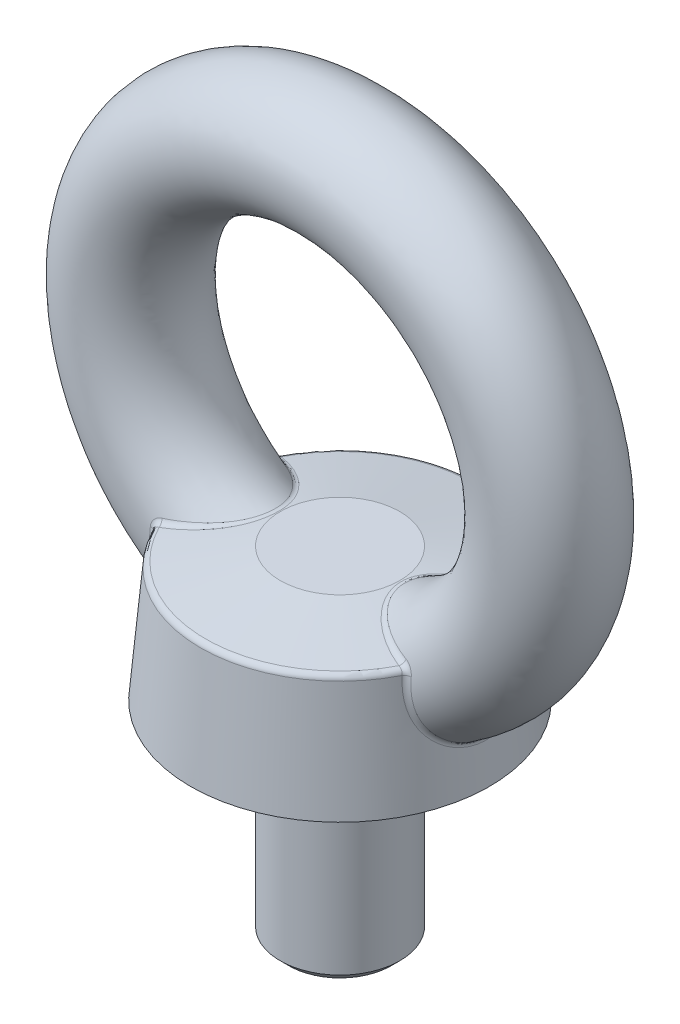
SolidWorks part; units mm, degrees
ref_plane "Front Plane" through (0, 0, 0) normal (0, 0, 1) x (1, 0, 0)
ref_plane "Top Plane" through (0, 0, 0) normal (0, 1, 0) x (1, 0, 0)
ref_plane "Right Plane" through (0, 0, 0) normal (1, 0, 0) x (0, 0, -1)
sketch "Sketch1" plane through (0, 0, 0) normal (0, 0, 1) x (1, 0, 0)
  ellipse E0 centre (0, 26.5) end of major axis (27, 26.5) minor radius 26.5
  dimension "D1" = 54
  dimension "D2" = 53
sketch "Sketch2" plane through (0, 0, 0) normal (1, 0, 0) x (0, 0, -1)
  line L3 (0, 53) -> (0, 0) construction
  circle A0 centre (0, 6) radius 6
  point P5 (0, 0)
sweep "Sweep1" add profiles "Sketch2" path "Sketch1"
sketch "Sketch3" plane through (0, 0, 0) normal (1, 0, 0) x (0, 0, -1)
  line L0 (0, 0) -> (-15, 0)
  line L1 (-15, 0) -> (-13.9501, 12)
  line L2 (-13.9501, 12) -> (-6, 13.4018)
  line L3 (-6, 13.4018) -> (0, 13.4018)
  line L4 (0, 13.4018) -> (0, 0)
revolve "Revolve1" add sketch "Sketch3" angle 360 about L4
fillet "Fillet1" radius 0.6 6 edges at (6.3535, 13.335, 0.5697) (14.6193, 4.2467, 0.517) (-6.3535, 13.335, -0.5697) (-14.6193, 4.2467, -0.517) (0, 12, -13.9501) (0, 12, 13.9501)
sketch "Sketch4" plane through (0, 0, 0) normal (0, -1, 0) x (1, 0, 0)
  circle A0 centre (0, 0) radius 6
  dimension "D1" = 12
extrude "Extrude1" add sketch "Sketch4" along normal blind 20.5
chamfer "Chamfer1" distance 0.85 angle 45 1 edges at (0, -20.5, -6)
sketch "Sketch5" plane through (0, 0, 0) normal (1, 0, 0) x (0, 0, -1)
  line L0 (-6, 0) -> (-6, -2.3222)
  line L1 (-6, 0) -> (-6, -19.65) construction
  line L2 (-5.15, -0.85) -> (-6, -2.3222)
  line L3 (-5.15, -0.85) -> (-5.15, -0.425)
  line L4 (-5.575, 0) -> (-6, 0)
  line L5 (-5.575, -0.425) -> (-5.15, -0.425) construction
  arc A1 (-5.15, -0.425) -> (-5.575, 0) centre (-5.575, -0.425) ccw
  point P0 (-5.15, -20.5)
  dimension "D1" = 30
revolve "Cut-Revolve1" cut sketch "Sketch5" angle 360 about axis through (0, -20.5, 0) along (0, 1, 0)
equation "\"D4@Sketch3\" = \"D1@Sketch2\""
equation "\"D5@Sketch3\" = \"D1@Sketch2\"/2"
